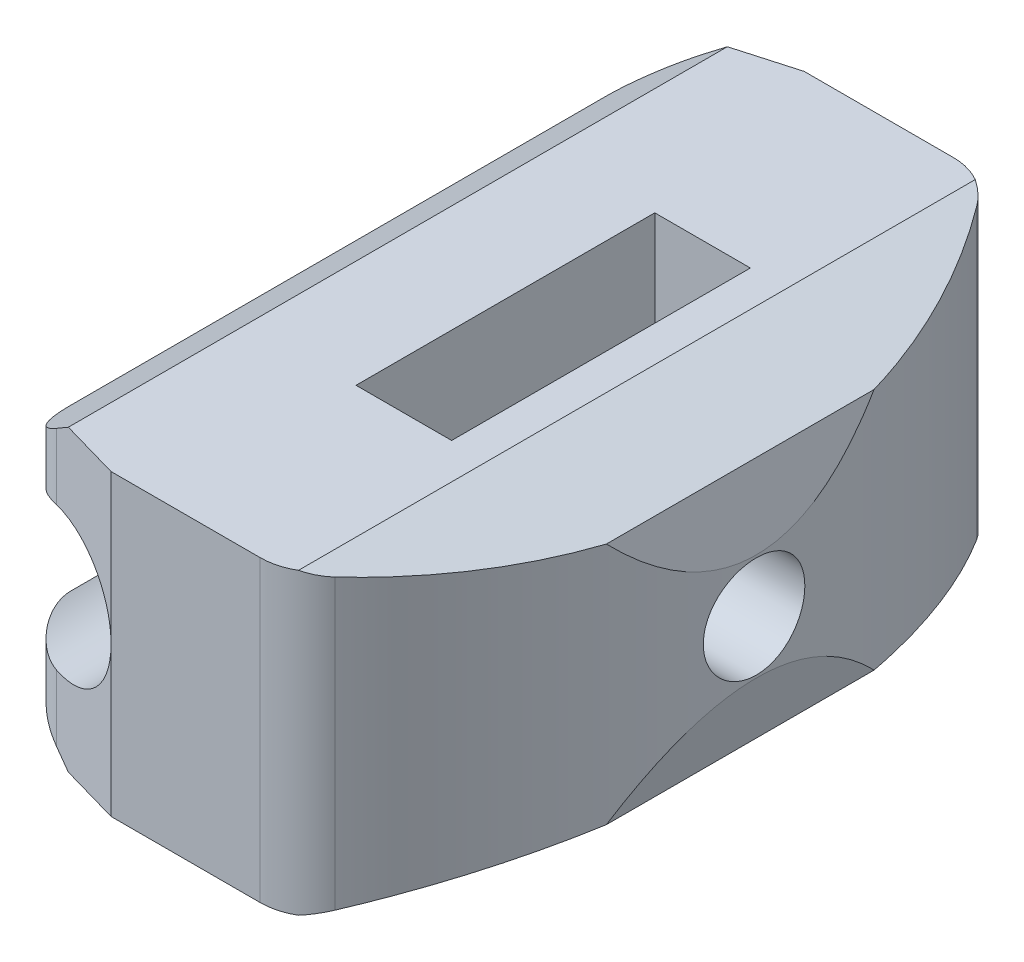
SolidWorks part; units mm, degrees
ref_plane "Plan de face" through (0, 0, 0) normal (0, 0, 1) x (1, 0, 0)
ref_plane "Plan de dessus" through (0, 0, 0) normal (0, 1, 0) x (1, 0, 0)
ref_plane "Plan de droite" through (0, 0, 0) normal (1, 0, 0) x (0, 0, -1)
sketch "Esquisse1" plane through (0, 0, 0) normal (0, 0, 1) x (1, 0, 0)
  line L0 (10, 25) -> (30, 25)
  line L1 (40, 16.9576) -> (38.6476, 22.6694)
  line L2 (30, 25) -> (38.6476, 22.6694)
  line L3 (10, 25) -> (5, 21.4923)
  line L4 (5, 16.9721) -> (5, 21.4923)
  line L6 (19, 0) -> (19, 25)
  line L7 (27, 0) -> (27, 25)
  line L8 (10, 0) -> (5, 3.5077)
  line L9 (30, 0) -> (38.6476, 2.3306)
  line L10 (40, 8.0424) -> (38.6476, 2.3306)
  line L11 (40, 16.9576) -> (40, 8.0424)
  line L12 (30, 0) -> (10, 0)
  line L13 (5, 3.5077) -> (5, 8.0279)
  arc A0 (5, 8.0279) -> (5, 16.9721) centre (9, 12.5) ccw
sketch "Esquisse2" plane through (0, 0, 0) normal (0, 1, 0) x (1, 0, 0)
  line L0 (19, 41.5) -> (19, 16.5)
  line L1 (27, 41.5) -> (19, 41.5)
  line L2 (27, 16.5) -> (27, 41.5)
  line L3 (19, 16.5) -> (27, 16.5)
  line L4 (15, 58) -> (8.6285, 56.1826)
  line L5 (27.4783, 58) -> (15, 58)
  line L6 (15, 0) -> (27.4783, 0)
  line L7 (15, 0) -> (8.6285, 1.8174)
  line L8 (5, 51.3744) -> (5, 6.6256)
  arc A0 (8.6285, 56.1826) -> (5, 51.3744) centre (10, 51.3744) ccw
  arc A1 (31.5839, 55.8537) -> (27.4783, 58) centre (27.4783, 53) ccw
  arc A2 (27.4783, 0) -> (31.5839, 2.1463) centre (27.4783, 5) ccw
  arc A3 (31.5839, 2.1463) -> (31.5839, 55.8537) centre (-7.05, 29) ccw
  arc A4 (5, 6.6256) -> (8.6285, 1.8174) centre (10, 6.6256) ccw
extrude "Extrusion1" add sketch "Esquisse1" against normal blind 58 contours L0 L2 L1 L11 L10 L9 L12 L8 L13 A0 L4 L3
extrude "Enlèv. mat.-Extru.1" cut sketch "Esquisse2" along normal blind 58 flip side to cut
sketch "Esquisse3" plane through (27, 0, 0) normal (-1, 0, 0) x (0, 0, 1)
  line L0 (-56.5738, 25) -> (-1.4262, 25) construction
  line L2 (-58, 12.5) -> (-58, 25) construction
  circle A0 centre (-29, 12.5) radius 4.25
  dimension "D1" = 8.5
  dimension "D2" = 12.5
  dimension "D3" = 29
extrude "Enlèv. mat.-Extru.2" cut sketch "Esquisse3" against normal up to next
ref_plane "Plan1" through (0, 0, -29) normal (0, 0, -1) x (-1, 0, 0)
